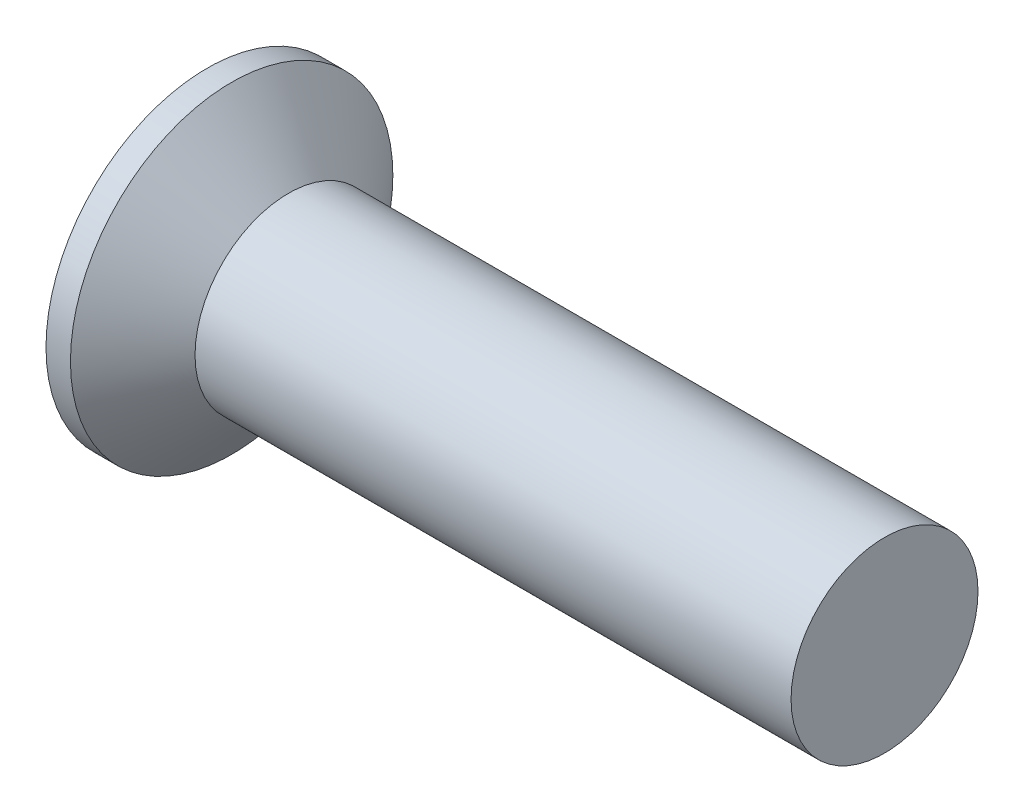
SolidWorks part; units mm, degrees
ref_plane "Plane1" through (0, 0, 0) normal (0, 0, 1) x (1, 0, 0)
ref_plane "Plane2" through (0, 0, 0) normal (0, 1, 0) x (1, 0, 0)
ref_plane "Plane3" through (0, 0, 0) normal (1, 0, 0) x (0, 0, -1)
revolve "Base-Revolve" add sketch "BodySke" angle 360 about L5
sketch "BodySke" plane through (0, 0, 0) normal (0, 0, 1) x (1, 0, 0)
  line L0 (0, 0) -> (0, 3.0226)
  line L1 (0, 3.0226) -> (0.4583, 3.0226)
  line L2 (1.524, 1.7526) -> (12.7, 1.7526)
  line L3 (12.7, 1.7526) -> (12.7, 0)
  line L4 (12.7, 0) -> (0, 0)
  line L5 (-6.35, 0) -> (82.55, 0) construction
  line L6 (1.524, -1.7526) -> (12.7, -1.7526) construction
  line L7 (0.4583, -3.0226) -> (1.524, -1.7526) construction
  line L8 (0.4583, 3.0226) -> (1.524, 1.7526)
  line L9 (0, -3.0226) -> (0.4583, -3.0226) construction
  line L10 (2.3165, 3.3401) -> (2.3165, -6.1849) construction
  line L11 (0, 6.35) -> (0, -3.175) construction
  dimension "Diameter" = 3.5052
  dimension "Length" = 12.7
  dimension "Head_ht" = 1.524
  dimension "Head_dia" = 6.0452
  dimension "Head_ang" = 100
  dimension "D6" = 0.4583
  dimension "Advance" = 0.7925
  dimension "Thread_nom" = 12.7
extrude "Slot" cut sketch "Sketch2" against normal blind 0.762
sketch "Sketch2" plane through (0, 0, 0) normal (-1, 0, 0) x (0, 0, 1)
  line L0 (-3.0226, -0.6096) -> (3.0226, -0.6096)
  line L1 (-3.0226, -0.6096) -> (-3.0226, 0.6096)
  line L2 (3.0226, 0.6096) -> (-3.0226, 0.6096)
  line L3 (3.0226, 0.6096) -> (3.0226, -0.6096)
  dimension "D1" = 0.6096
  dimension "Slot_width" = 1.2192
  dimension "D2" = 6.0452
  dimension "D3" = 3.0226
sketch "Sketch3" plane through (0, 0, 0) normal (-1, 0, 0) x (0, 0, 1)
  line L0 (-0.4191, 2.0574) -> (0.4191, 2.0574)
  line L1 (0.4191, 2.0574) -> (0.4191, -2.0574)
  line L2 (0.4191, -2.0574) -> (-0.4191, -2.0574)
  line L3 (-0.4191, -2.0574) -> (-0.4191, 2.0574)
  dimension "D1" = 2.0574
  dimension "Cross_dia" = 4.1148
  dimension "D2" = 0.4191
  dimension "Cross_width" = 0.8382
ref_plane "Plane4" through (2.6924, 0, 0) normal (-1, 0, 0) x (0, 0, 1)
sketch "Sketch4" plane through (2.6924, 0, 0) normal (-1, 0, 0) x (0, 0, 1)
  line L0 (-0.2096, 0.2096) -> (0.2095, 0.2095)
  line L3 (0.2095, 0.2095) -> (0.2096, -0.2095)
  line L4 (0.2096, -0.2095) -> (-0.2096, -0.2096)
  line L5 (-0.2096, -0.2096) -> (-0.2096, 0.2096)
  dimension "D1" = 0.4191
  dimension "D2" = 0.4191
  dimension "D3" = 0.2095
  dimension "D4" = 0.2095
loft "Cross" cut profiles "Sketch3", "Sketch4"
pattern_circular "CirPattern1" count 2 every 90 about axis through (0, 0, 0) along (1, 0, 0) of "Cross"
sketch "ThdSchSke" plane through (0, 0, 0) normal (0, 0, 1) x (1, 0, 0)
  line L0 (2.3165, -1.2802) -> (1.9857, -1.7526)
  line L1 (2.3165, -1.2802) -> (2.6473, -1.7526)
  line L2 (2.6473, -1.7526) -> (2.6473, -2.1907)
  line L3 (-3.175, 0) -> (5.1513, 0) construction
  line L5 (2.6473, -2.1907) -> (1.9857, -2.1907)
  line L6 (1.9857, -2.1907) -> (1.9857, -1.7526)
  line L7 (0, 3.0226) -> (0, -3.0226) construction
  dimension "Thread_minor" = 2.5603
  dimension "Diameter" = 3.5052
  dimension "Start" = 2.3165
  dimension "SideAngle" = 55
  dimension "VeeAngle" = 70
  dimension "Overcut" = 4.3815
revolve "ThreadSchematic" cut sketch "ThdSchSke" angle 360 about L3
pattern_linear "ThdSchPat"
equation "\"D1@Sketch3\" = \"Cross_dia@Sketch3\" / 2"
equation "\"D2@Sketch3\" = \"Cross_width@Sketch3\" / 2"
equation "\"D1@Sketch4\" = \"Cross_width@Sketch3\" *.5"
equation "\"D2@Sketch4\" = \"D1@Sketch4\""
equation "\"D4@Sketch4\" = \"D2@Sketch4\" / 2"
equation "\"D3@Sketch4\" = \"D1@Sketch4\" / 2"
equation "\"D1@Sketch2\" = \"Slot_width@Sketch2\" / 2"
equation "\"D2@Sketch2\" = \"Head_dia@BodySke\""
equation "\"D3@Sketch2\" = \"D2@Sketch2\" / 2"
equation "\"Thread_length@ThreadCosmetic\" = ((sgn( (\"Length@BodySke\" - \"Advance@BodySke\" - \"Head_ht@BodySke\" ) - \"Thread_nom@BodySke\" )-1)*( (\"Length@BodySke\" - \"Advance@BodySke\" - \"Head_ht@BodySke\" ) - \"Thread_"
equation "\"Thread_minor@ThdSchSke\" = \"Thread_minor@ThreadCosmetic\""
equation "\"Diameter@ThdSchSke\" = \"Diameter@BodySke\""
equation "\"Overcut@ThdSchSke\" = \"Diameter@BodySke\" * 1.25"
equation "\"Start@ThdSchSke\" = 0.000001 + \"Length@BodySke\" - \"Thread_length@ThreadCosmetic\"  '---Countersunk---"
equation "\"Num_threads@ThdSchPat\" = int( \"Thread_length@ThreadCosmetic\" / \"Advance@BodySke\" + 0.999 )  + 1"
equation "\"Advance@ThdSchPat\" = \"Thread_length@ThreadCosmetic\" /  (\"Num_threads@ThdSchPat\" - 1) 'relax it"
